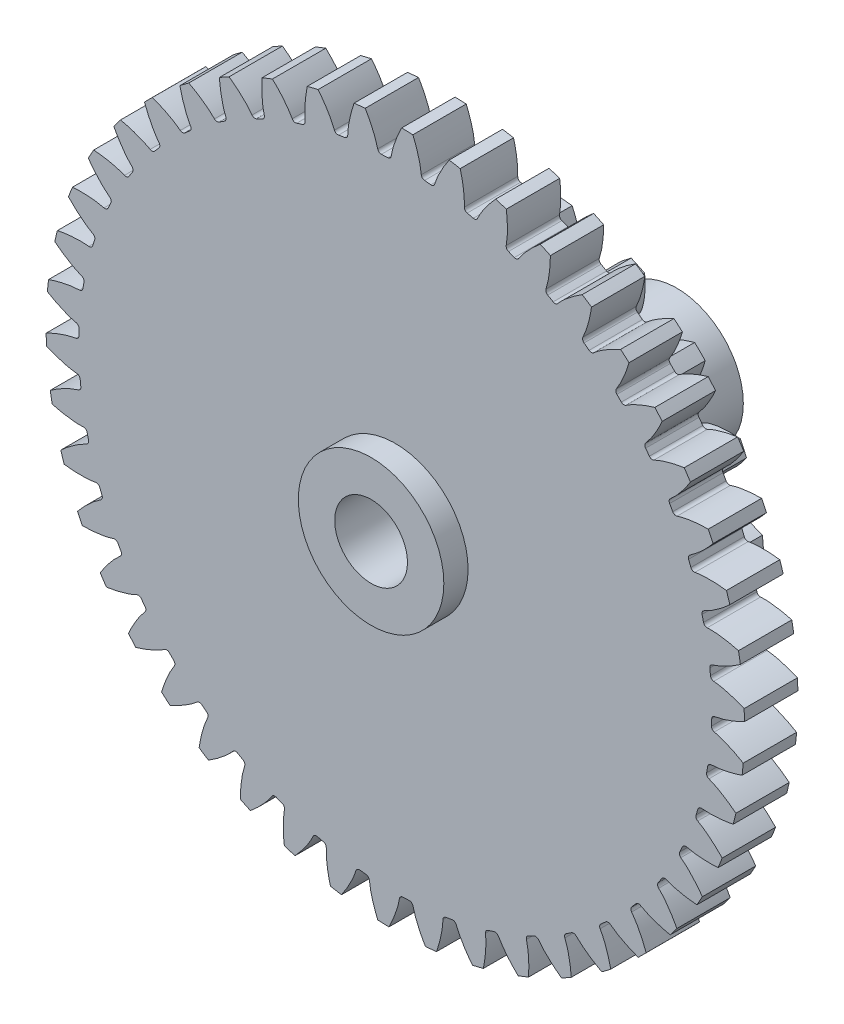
SolidWorks part; units mm, degrees
ref_plane "Face" through (0, 0, 0) normal (0, 0, 1) x (1, 0, 0)
ref_plane "Dessus" through (0, 0, 0) normal (0, 1, 0) x (1, 0, 0)
ref_plane "Droite" through (0, 0, 0) normal (1, 0, 0) x (0, 0, -1)
other "Joindre1"
other "Roue Z5 m=0,45 Z=18<1>@Z4-Z5"
other "Roue Z4 m=0,3 Z=46<1>@Z4-Z5"
sketch "Dp" plane through (0, 0, 0) normal (0, 0, -1) x (-1, 0, 0)
  circle A0 centre (0, 0) radius 4.05 construction
  circle A1 centre (0, 0) radius 7.5 construction
  dimension "D1" = 8.1
  dimension "D2" = 15
